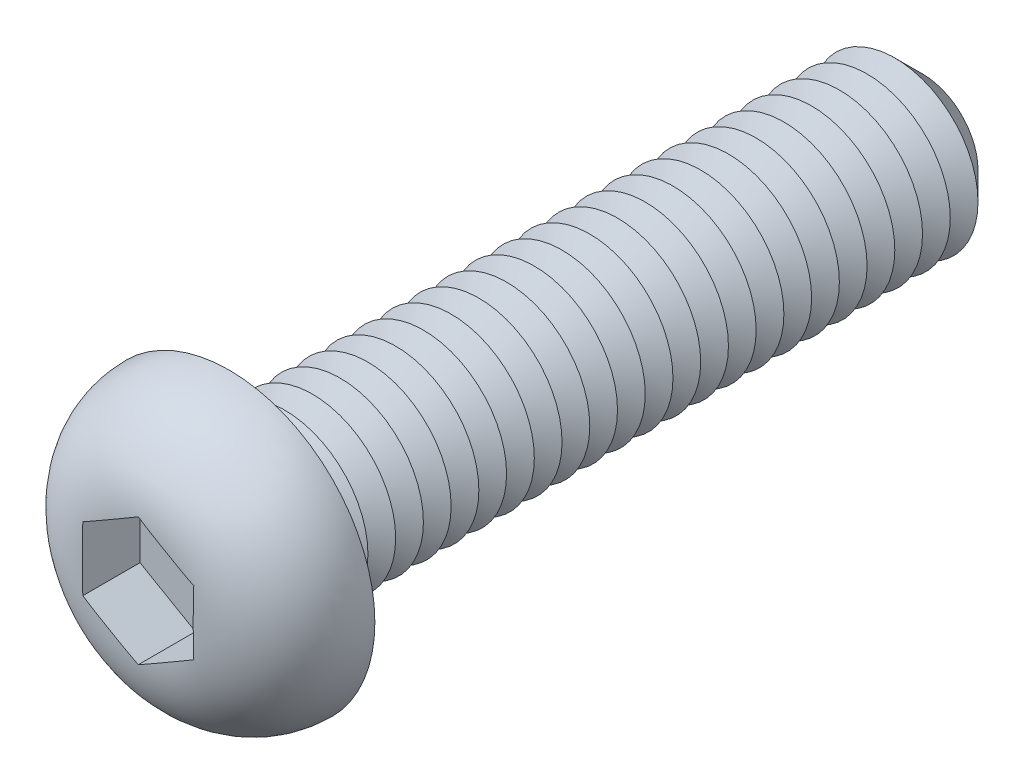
SolidWorks part; units mm, degrees
ref_plane "Front Plane" through (0, 0, 0) normal (0, 0, 1) x (1, 0, 0)
ref_plane "Top Plane" through (0, 0, 0) normal (0, 1, 0) x (1, 0, 0)
ref_plane "Right Plane" through (0, 0, 0) normal (1, 0, 0) x (0, 0, -1)
sketch "Sketch1" plane through (0, 0, 0) normal (1, 0, 0) x (0, 0, -1)
  line L0 (-47.9342, 0) -> (60.3146, 0) construction
sketch "Sketch2" plane through (0, 0, 0) normal (1, 0, 0) x (0, 0, -1)
  line L0 (0, 0) -> (-3.3, 0)
  line L1 (-47.9342, 0) -> (60.3146, 0) construction
  line L2 (-3.3, 0) -> (-3.3, 1.95)
  line L3 (0, 5.25) -> (0, 0)
  arc A0 (-3.3, 1.95) -> (0, 5.25) centre (0, 1.95) cw
  dimension "D1" = 3.3
  dimension "D2" = 3.3
  dimension "D3" = 5.25
revolve "Revolve1" add sketch "Sketch2" angle 360 about L0
sketch "Sketch3" plane through (0, 0, 3.3) normal (0, 0, 1) x (1, 0, 0)
  line L1 (0, 2.3094) -> (-2, 1.1547)
  line L2 (-2, 1.1547) -> (-2, -1.1547)
  line L3 (-2, -1.1547) -> (0, -2.3094)
  line L4 (0, -2.3094) -> (2, -1.1547)
  line L5 (2, -1.1547) -> (2, 1.1547)
  line L6 (2, 1.1547) -> (0, 2.3094)
  circle A0 centre (0, 0) radius 2 construction
  dimension "D1" = 4
extrude "Cut-Extrude1" cut sketch "Sketch3" against normal blind 2.08
sketch "Sketch4" plane through (0, 0, 0) normal (0, 0, -1) x (-1, 0, 0)
  circle A0 centre (0, 0) radius 3
  dimension "D1" = 6
extrude "Boss-Extrude1" add sketch "Sketch4" along normal blind 25
chamfer "Chamfer1" distance 1 angle 45 1 edges at (-3, 0, -25)
sketch "Sketch5" plane through (0, 0, 0) normal (1, 0, 0) x (0, 0, -1)
  line L0 (1, 3) -> (2, 3)
  line L1 (24, 3) -> (0, 3) construction
  line L2 (2, 3) -> (1.5, 2.134)
  line L3 (1.5, 2.134) -> (1, 3)
  line L4 (0, -5.25) -> (0, 5.25) construction
  line L5 (24, 3) -> (0, 3) construction
  dimension "D1" = 1
  dimension "D2" = 1
revolve "Cut-Revolve1" cut sketch "Sketch5" angle 360 about L0
pattern_linear "LPattern1" count 23 spacing 1 along (0, 0, -1) of "Cut-Revolve1"
fillet "Fillet2" radius 0.5 1 edges at (3, 0, 0)
sketch "Sketch6" plane through (0, 0, 1.22) normal (0, 0, 1) x (1, 0, 0)
  circle A0 centre (0, 0) radius 0.8
  dimension "D1" = 1.6
extrude "Cut-Extrude2" cut sketch "Sketch6" against normal up to surface (26.22 mm away)
